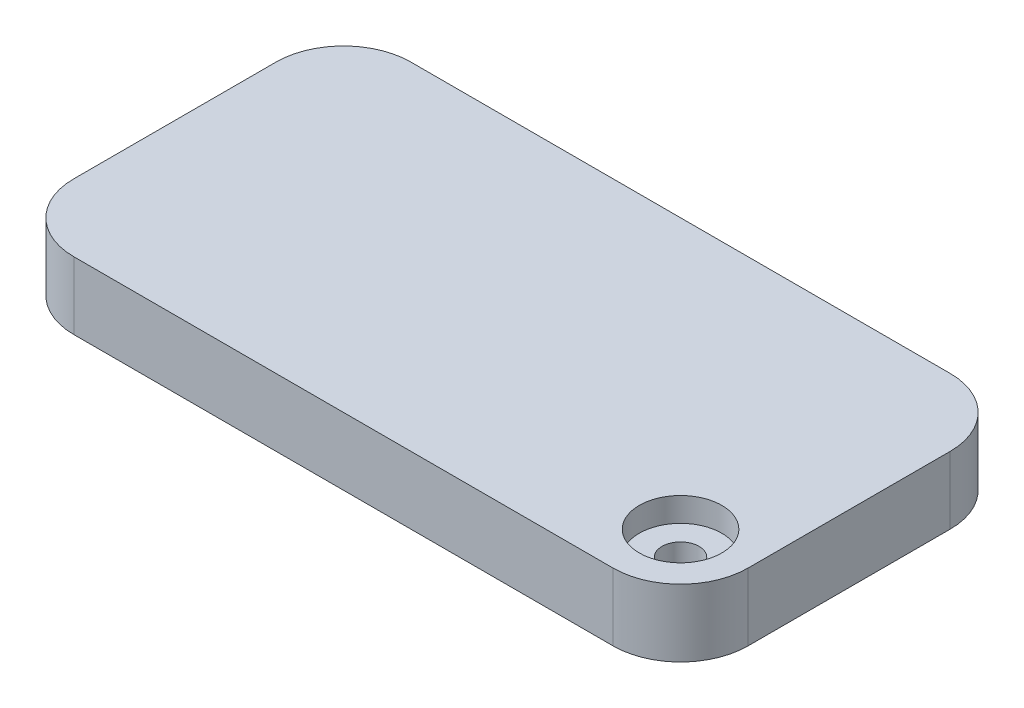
SolidWorks part; units mm, degrees
ref_plane "Front" through (0, 0, 0) normal (0, 0, 1) x (1, 0, 0)
ref_plane "Top" through (0, 0, 0) normal (0, 1, 0) x (1, 0, 0)
ref_plane "Right" through (0, 0, 0) normal (1, 0, 0) x (0, 0, -1)
sketch "Sketch1" plane through (0, 0, 0) normal (0, 1, 0) x (1, 0, 0)
  line L1 (10, 0) -> (90, 0)
  line L2 (0, 10) -> (0, 40)
  line L3 (10, 50) -> (90, 50)
  line L4 (100, 10) -> (100, 40)
  arc A0 (0, 40) -> (10, 50) centre (10, 40) cw
  arc A1 (90, 50) -> (100, 40) centre (90, 40) cw
  arc A2 (90, 0) -> (100, 10) centre (90, 10) ccw
  arc A3 (10, 0) -> (0, 10) centre (10, 10) cw
  point P7 (0, 50)
  point P12 (100, 0)
  point P15 (0, 0)
  dimension "D3" = 10
  dimension "D1" = 100
  dimension "D2" = 50
extrude "Extrude1" add sketch "Sketch1" along normal blind 10
hole_wizard "CBORE for M5 Hex Head Bolt1" positions "Sketch5" profile "Sketch4" counterbore size "M5" standard "Ansi Metric"
sketch "Sketch5" plane through (0, 10, 0) normal (0, 1, 0) x (-1, 0, 0)
  arc A2 (-90, 0) -> (-100, -10) centre (-90, -10) ccw construction
  point P0 (-90, -10)
sketch "Sketch4" plane through (90, 10, -10) normal (1, 0, 0) x (0, 0, 1)
  line L0 (0, 0) -> (0, 10)
  line L1 (0, 10) -> (2.75, 10)
  line L3 (2.75, 10) -> (2.75, 3.58)
  line L4 (2.75, 3.58) -> (6.12, 3.58)
  line L5 (6.12, 3.58) -> (6.12, 0)
  line L7 (6.12, 0) -> (0, 0)
  line L11 (0, -6.35) -> (0, 107.95) construction
  dimension "Thru Hole Dia." = 5.5
  dimension "Thru Hole Depth" = 10
  dimension "C'Bore Dia." = 12.24
  dimension "C'Bore Depth" = 3.58
